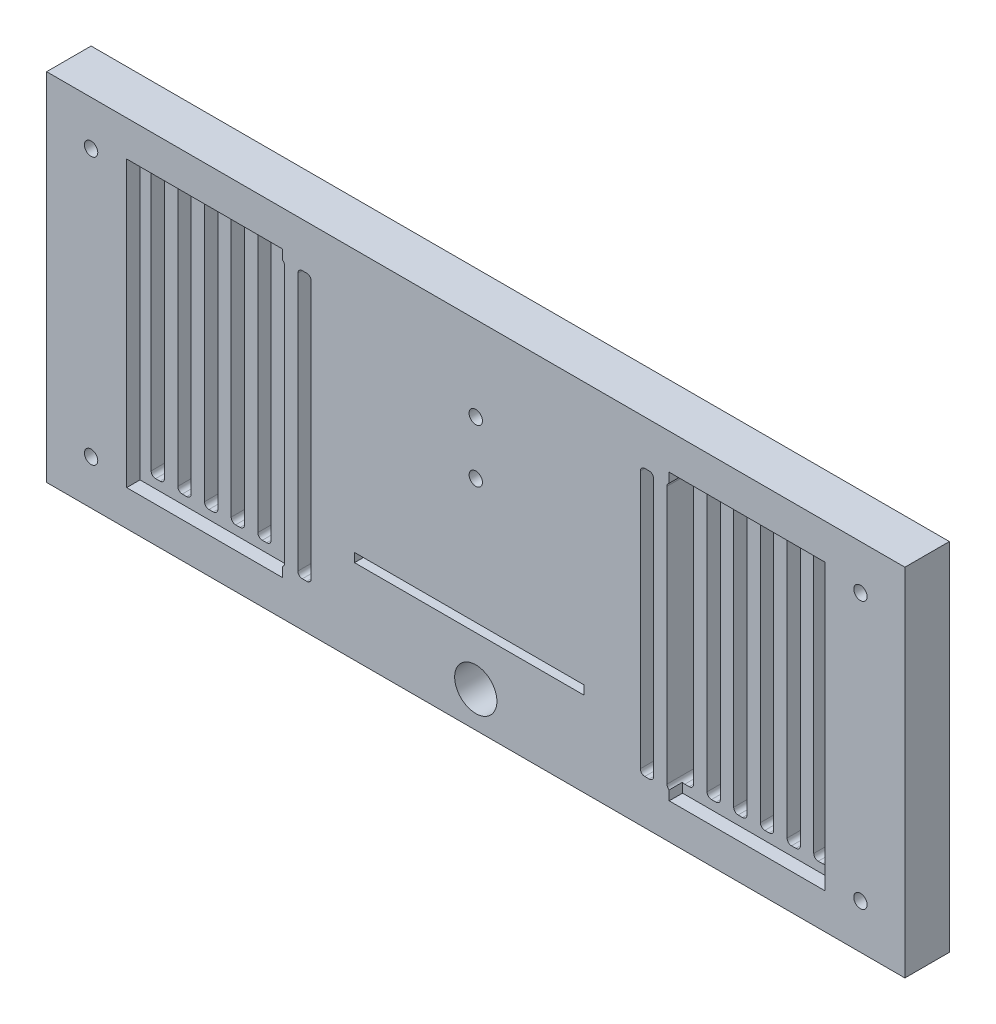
SolidWorks part; units mm, degrees
ref_plane "Plan de face" through (0, 0, 0) normal (0, 0, 1) x (1, 0, 0)
ref_plane "Plan de dessus" through (0, 0, 0) normal (0, 1, 0) x (1, 0, 0)
ref_plane "Plan de droite" through (0, 0, 0) normal (1, 0, 0) x (0, 0, -1)
sketch "Esquisse1" plane through (0, 0, 0) normal (0, 0, 1) x (1, 0, 0)
  line L0 (0, 80) -> (0, 0) construction
  line L1 (-96.5, 80) -> (96.5, 80)
  line L2 (-96.5, 80) -> (-96.5, 0)
  line L3 (-96.5, 0) -> (96.5, 0)
  line L4 (96.5, 80) -> (96.5, 0)
  dimension "D1" = 193
  dimension "D2" = 80
extrude "Boss.-Extru.1" add sketch "Esquisse1" along normal blind 10
sketch "Esquisse3" plane through (0, 0, 10) normal (0, 0, 1) x (1, 0, 0)
  line L0 (0, 80) -> (0, 0) construction
  line L1 (96.5, 80) -> (-96.5, 80) construction
  line L2 (-96.5, 0) -> (96.5, 0) construction
  line L4 (-39, 70) -> (-38, 70)
  line L5 (-40, 69) -> (-40, 11)
  line L6 (-39, 10) -> (-38, 10)
  line L7 (-37, 69) -> (-37, 11)
  arc A0 (-38, 10) -> (-37, 11) centre (-38, 11) ccw
  arc A1 (-40, 11) -> (-39, 10) centre (-39, 11) ccw
  arc A2 (-38, 70) -> (-37, 69) centre (-38, 69) cw
  arc A3 (-39, 70) -> (-40, 69) centre (-39, 69) ccw
  dimension "D5" = 1
  dimension "D1" = 10
  dimension "D2" = 10
  dimension "D3" = 40
  dimension "D4" = 3
extrude "Enlèv. mat.-Extru.3" cut sketch "Esquisse3" against normal through all
pattern_linear "Répétition linéaire1" count 7 spacing 6 along (-1, 0, 0) of "Enlèv. mat.-Extru.3"
mirror "Symétrie1" about plane through (0, 0, 0) normal (1, 0, 0) of "Enlèv. mat.-Extru.3", "Répétition linéaire1"
sketch "Esquisse4" plane through (0, 0, 10) normal (0, 0, 1) x (1, 0, 0)
  line L0 (96.5, 80) -> (-96.5, 80) construction
  line L1 (-96.5, 80) -> (-96.5, 0) construction
  line L2 (-96.5, 0) -> (96.5, 0) construction
  line L3 (96.5, 0) -> (96.5, 80) construction
  circle A0 centre (-86.5, 70) radius 1.5
  circle A1 centre (-86.5, 10) radius 1.5
  circle A2 centre (86.5, 70) radius 1.5
  circle A3 centre (86.5, 10) radius 1.5
  dimension "D1" = 3
  dimension "D2" = 10
  dimension "D3" = 10
  dimension "D4" = 3
  dimension "D5" = 10
  dimension "D6" = 10
  dimension "D7" = 3
  dimension "D8" = 3
  dimension "D9" = 10
  dimension "D10" = 10
  dimension "D11" = 10
  dimension "D12" = 10
extrude "Enlèv. mat.-Extru.4" cut sketch "Esquisse4" against normal through all
sketch "Esquisse5" plane through (0, 0, 10) normal (0, 0, 1) x (1, 0, 0)
  line L0 (0, 80) -> (0, 2.2526) construction
  line L1 (96.5, 80) -> (-96.5, 80) construction
  line L2 (96.5, 55) -> (-96.5, 55) construction
  circle A0 centre (0, 49) radius 1.5
  circle A1 centre (0, 61) radius 1.5
  circle A2 centre (0, 8) radius 4.75
  dimension "D1" = 6
  dimension "D2" = 6
  dimension "D3" = 3
  dimension "D4" = 3
  dimension "D6" = 47
  dimension "D7" = 9.5
  dimension "D5" = 25
extrude "Enlèv. mat.-Extru.5" cut sketch "Esquisse5" against normal through all
sketch "Esquisse6" plane through (0, 0, 10) normal (0, 0, 1) x (1, 0, 0)
  line L1 (-27.2681, 21) -> (24.2852, 21)
  line L2 (-27.2681, 21) -> (-27.2681, 19)
  line L3 (-27.2681, 19) -> (24.2852, 19)
  line L4 (24.2852, 21) -> (24.2852, 19)
  circle A0 centre (0, 49) radius 1.5 construction
  dimension "D1" = 28
  dimension "D2" = 2
extrude "Enlèv. mat.-Extru.6" cut sketch "Esquisse6" against normal through all
sketch "Esquisse7" plane through (0, 0, 10) normal (0, 0, 1) x (1, 0, 0)
  line L0 (96.5, 80) -> (-96.5, 80) construction
  line L1 (-78.5, 72) -> (-43.5, 72)
  line L2 (-78.5, 72) -> (-78.5, 8)
  line L3 (-78.5, 8) -> (-43.5, 8)
  line L4 (-43.5, 72) -> (-43.5, 8)
  line L5 (-96.5, 0) -> (96.5, 0) construction
  line L6 (-96.5, 80) -> (-96.5, 0) construction
  line L9 (0, 80) -> (0, 0) construction
  line L10 (43.5, 72) -> (43.5, 8)
  line L11 (78.5, 8) -> (43.5, 8)
  line L12 (78.5, 72) -> (78.5, 8)
  line L13 (78.5, 72) -> (43.5, 72)
  dimension "D1" = 8
  dimension "D2" = 8
  dimension "D3" = 18
  dimension "D4" = 35
extrude "Enlèv. mat.-Extru.7" cut sketch "Esquisse7" against normal blind 3
